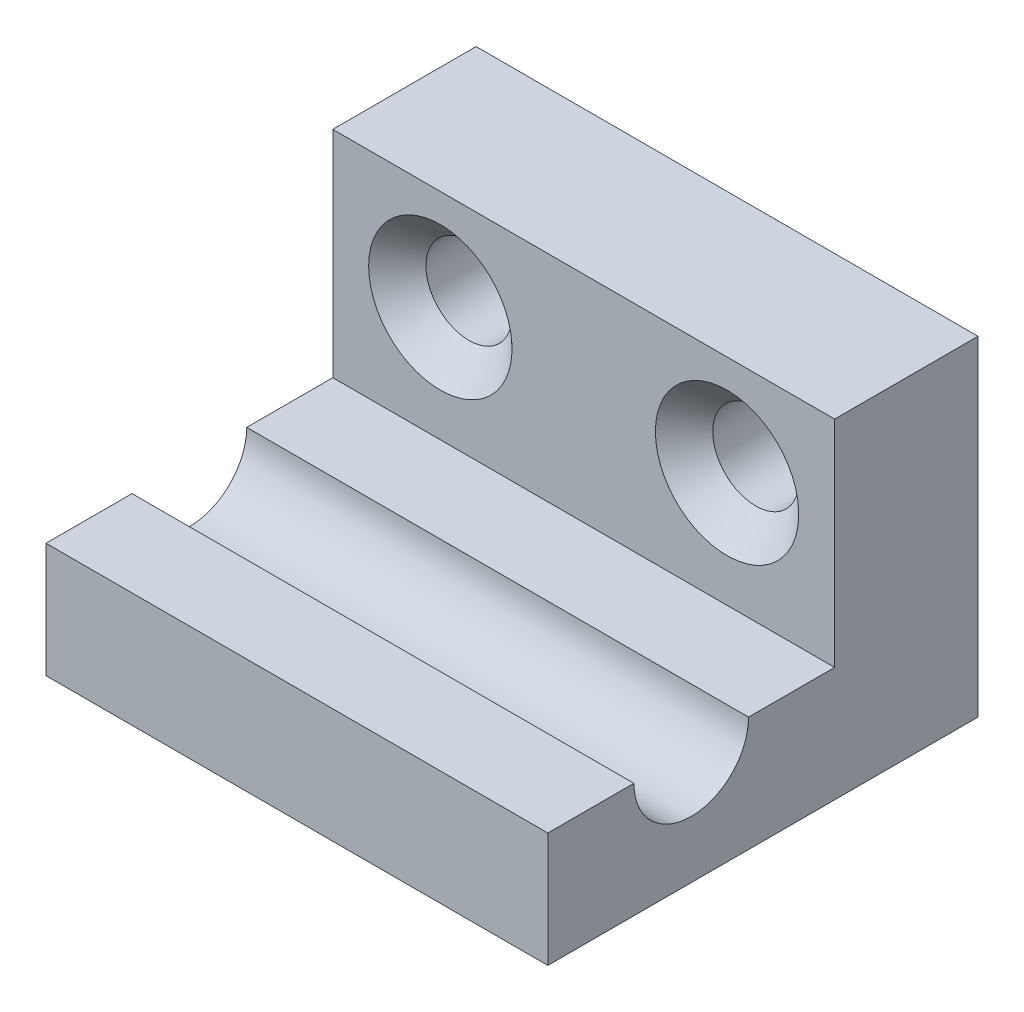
SolidWorks part; units mm, degrees
ref_plane "Plan de face" through (0, 0, 0) normal (0, 0, 1) x (1, 0, 0)
ref_plane "Plan de dessus" through (0, 0, 0) normal (0, 1, 0) x (1, 0, 0)
ref_plane "Plan de droite" through (0, 0, 0) normal (1, 0, 0) x (0, 0, -1)
sketch "Esquisse1" plane through (0, 0, 0) normal (1, 0, 0) x (0, 0, -1)
  line L0 (0, 0) -> (0, 23)
  line L1 (0, 23) -> (-10, 23)
  line L2 (-10, 23) -> (-10, 8)
  line L3 (-10, 8) -> (-30, 8)
  line L4 (-30, 8) -> (-30, 0)
  line L5 (-30, 0) -> (0, 0)
  dimension "D1" = 15
  dimension "D2" = 8
  dimension "D3" = 10
  dimension "D4" = 30
extrude "Boss.-Extru.1" add sketch "Esquisse1" along normal blind 35
sketch "Esquisse2" plane through (0, 0, 10) normal (0, 0, 1) x (1, 0, 0)
  line L0 (0, 23) -> (0, 8) construction
  line L1 (35, 23) -> (0, 23) construction
  circle A0 centre (7.5, 16) radius 3
  circle A1 centre (27.5, 16) radius 3
  dimension "D1" = 6
  dimension "D2" = 6
  dimension "D3" = 20
  dimension "D4" = 7.5
  dimension "D5" = 7
  dimension "D6" = 7
extrude "Enlèv. mat.-Extru.1" cut sketch "Esquisse2" against normal blind 40
chamfer "Chanfrein1" distance 2 angle 45 2 edges at (30.5, 16, 10) (10.5, 16, 10)
sketch "Esquisse3" plane through (35, 0, 0) normal (1, 0, 0) x (0, 0, -1)
  line L0 (-10, 8) -> (-30, 8) construction
  circle A0 centre (-20, 8) radius 4
  dimension "D1" = 8
extrude "Enlèv. mat.-Extru.2" cut sketch "Esquisse3" against normal blind 40
